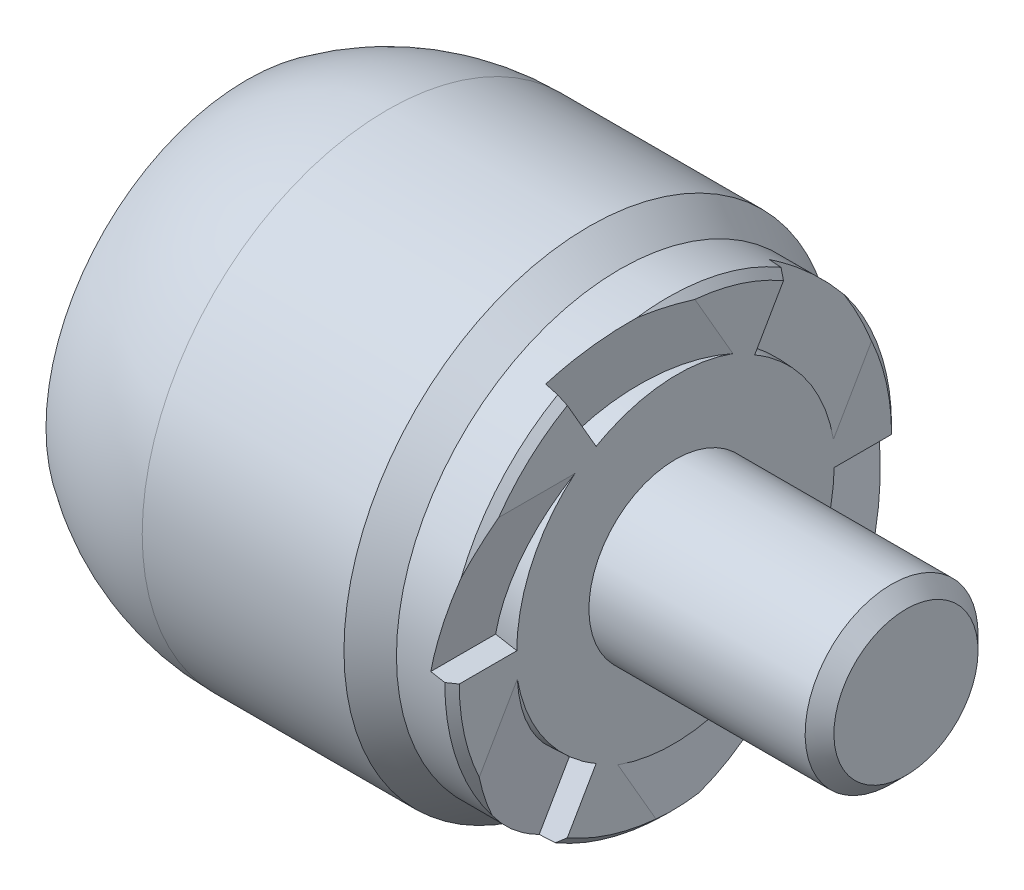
SolidWorks part; units mm, degrees
ref_plane "Plan1" through (0, 0, 0) normal (0, 0, 1) x (1, 0, 0)
ref_plane "Plan2" through (0, 0, 0) normal (0, 1, 0) x (1, 0, 0)
ref_plane "Plan3" through (0, 0, 0) normal (1, 0, 0) x (0, 0, -1)
sketch "Esquisse1" plane through (0, 0, 0) normal (0, 0, 1) x (1, 0, 0)
  line L0 (0, 17) -> (14, 17)
  line L1 (-6.8829, 9.8298) -> (-9.7508, 13.9256)
  line L2 (94.3833, 0) -> (-55.6167, 0) construction
  line L3 (14, 17) -> (16.1422, 15.5)
  line L4 (16.1422, 15.5) -> (19.5, 15.5)
  line L5 (20, 15) -> (20, 6)
  line L6 (20, 6) -> (35, 6)
  line L7 (35, 6) -> (36, 5)
  line L8 (36, 5) -> (36, 0)
  line L9 (36, 0) -> (16, 0)
  line L10 (9.7468, 7) -> (11.9585, 7)
  line L11 (19.5, 15.5) -> (20, 15)
  line L12 (11.9585, 7) -> (16, 0)
  arc A0 (9.7468, 7) -> (-6.8829, 9.8298) centre (0, 0) ccw
  arc A1 (0, 17) -> (-9.7508, 13.9256) centre (0, 0) ccw
  dimension "D2" = 17
  dimension "D3" = 12
  dimension "D1" = 55
  dimension "D4" = 1.5
  dimension "D5" = 35
  dimension "D6" = 14
  dimension "D7" = 20
  dimension "D8" = 16
  dimension "D9" = 6
  dimension "D10" = 1
  dimension "D11" = 45
  dimension "D12" = 14
  dimension "D13" = 60
  dimension "D14" = 16
  dimension "D15" = 0.5
  dimension "D16" = 45
revolve "Base-Révolution" add sketch "Esquisse1" angle 360 about L2
sketch "Esquisse2" plane through (20, 0, 0) normal (1, 0, 0) x (0, 0, -1)
  line L0 (0, 0) -> (-19, 0) construction
ref_plane "Plan4" through (19.3969, -3.4202, 0) normal (0.9848, -0.1736, 0) x (0, 0, -1)
sketch "Esquisse3" plane through (19.3969, -3.4202, 0) normal (0.9848, -0.1736, 0) x (0, 0, -1)
  line L0 (-11, 3.473) -> (-18.2099, 3.473)
  line L1 (-5.1585, 13.1884) -> (-8.5396, 19.5564)
  arc A0 (-8.5396, 19.5564) -> (-18.2099, 3.473) centre (0, 3.473) ccw
  arc A1 (-5.1585, 13.1884) -> (-11, 3.473) centre (0, 3.473) ccw
  dimension "D1" = 11
extrude "Enlèv. mat.-Extru.1" cut sketch "Esquisse3" against normal blind 1.5
pattern_circular "Répétition circulaire1" count 6 every 60 about axis through (94.3833, 0, 0) along (-1, 0, 0)
